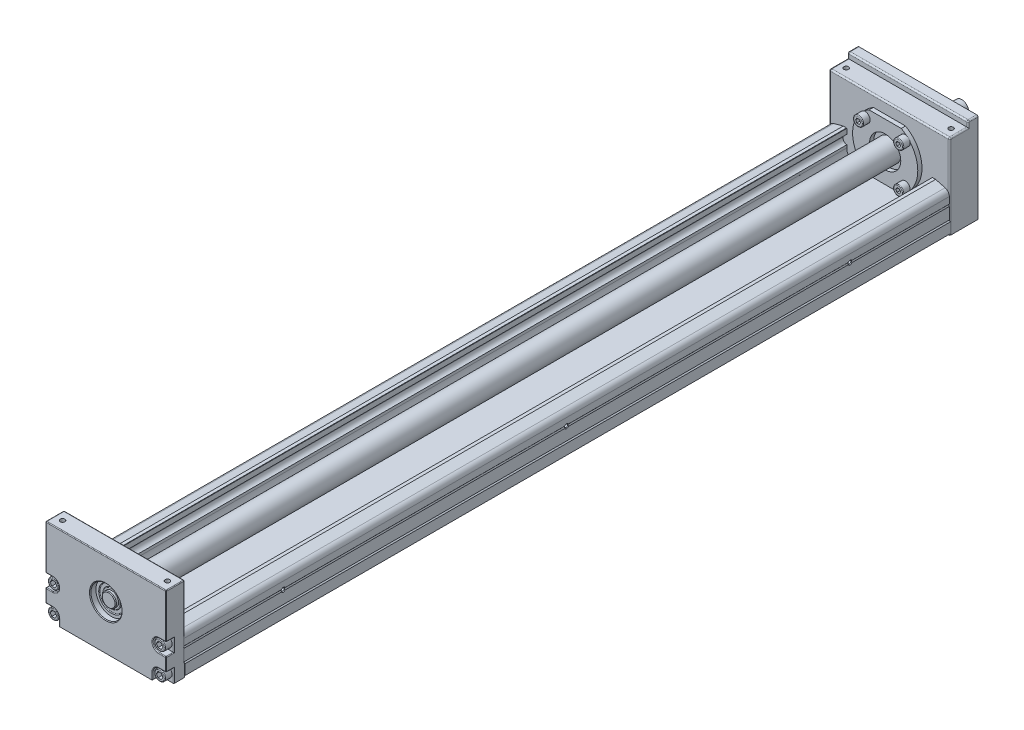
SolidWorks part; units mm, degrees
ref_plane "前视基准面" through (0, 0, 0) normal (0, 0, 1) x (1, 0, 0)
ref_plane "上视基准面" through (0, 0, 0) normal (0, 1, 0) x (1, 0, 0)
ref_plane "右视基准面" through (0, 0, 0) normal (1, 0, 0) x (0, 0, -1)
sketch "草图1" plane through (0, 0, 0) normal (0, 0, 1) x (1, 0, 0)
  line L0 (0, 0) -> (0, 14.97) construction
  line L1 (-11, 0.5) -> (11, 0.5)
  line L2 (11, 0.5) -> (11, 0)
  line L3 (11, 0) -> (33, 0) construction
  line L4 (33, 0) -> (33, 0.5)
  line L5 (33, 0.5) -> (41.5, 0.5)
  line L6 (43, 2) -> (43, 9.25) construction
  line L7 (43, 9.25) -> (42.25, 10)
  line L8 (42.25, 10) -> (42.25, 24.345)
  line L9 (39.2853, 28.2087) -> (32.6, 30)
  line L10 (32.6, 30) -> (30.1, 30) construction
  line L11 (30.1, 30) -> (30.1, 17.9)
  line L12 (30.1, 30) -> (30.1, 30.15)
  line L13 (13, 9.9) -> (-13, 9.9)
  line L14 (41.5, 0.5) -> (43, 2)
  line L15 (-41.5, 0.5) -> (-43, 2)
  line L16 (30.1, 30.15) -> (32.0402, 30.15)
  line L17 (-30.1, 30) -> (-30.1, 17.9)
  line L18 (-32.6, 30) -> (-30.1, 30) construction
  line L19 (-39.2853, 28.2087) -> (-32.6, 30)
  line L20 (-42.25, 10) -> (-42.25, 24.345)
  line L21 (-43, 9.25) -> (-42.25, 10)
  line L22 (-43, 2) -> (-43, 9.25) construction
  line L23 (-33, 0.5) -> (-41.5, 0.5)
  line L24 (-33, 0) -> (-33, 0.5)
  line L25 (-11, 0) -> (-33, 0) construction
  line L26 (-11, 0.5) -> (-11, 0)
  line L27 (13, 9.9) -> (22.1, 9.9)
  line L28 (32.0402, 30.15) -> (32.6, 30)
  line L29 (-13, 9.9) -> (-22.1, 9.9)
  line L30 (43, 9.25) -> (43.15, 9.1)
  line L31 (43.15, 9.1) -> (43.15, 2.15)
  line L32 (43.15, 2.15) -> (43, 2)
  line L33 (33, 0) -> (33, -0.5)
  line L34 (33, -0.5) -> (11, -0.5)
  line L35 (11, -0.5) -> (11, 0)
  line L36 (-11, -0.5) -> (-11, 0)
  line L37 (-33, -0.5) -> (-11, -0.5)
  line L38 (-33, 0) -> (-33, -0.5)
  line L39 (-43.15, 2.15) -> (-43, 2)
  line L40 (-43.15, 9.1) -> (-43.15, 2.15)
  line L41 (-43, 9.25) -> (-43.15, 9.1)
  line L42 (-30.1, 30) -> (-30.1, 30.15)
  line L43 (-30.1, 30.15) -> (-32.0402, 30.15)
  line L44 (-32.0402, 30.15) -> (-32.6, 30)
  arc A0 (42.25, 24.345) -> (39.2853, 28.2087) centre (38.25, 24.345) ccw
  arc A1 (-22.1, 9.9) -> (-30.1, 17.9) centre (-22.1, 17.9) cw
  arc A2 (22.1, 9.9) -> (30.1, 17.9) centre (22.1, 17.9) ccw
  arc A3 (-42.25, 24.345) -> (-39.2853, 28.2087) centre (-38.25, 24.345) cw
  point P9 (43, 0.5)
  point P24 (0, 0.5)
  point P25 (0, 9.9)
  point P40 (-43, 0.5)
  dimension "D16" = 4
  dimension "D17" = 13
  dimension "D15" = 8
  dimension "D1" = 0.5
  dimension "D2" = 0.5
  dimension "D3" = 43
  dimension "D4" = 42.25
  dimension "D5" = 2.5
  dimension "D6" = 30
  dimension "D7" = 15
  dimension "D8" = 9.4
  dimension "D9" = 22
  dimension "D10" = 11
  dimension "D11" = 10
  dimension "D12" = 45
  dimension "D13" = 30.1
  dimension "D14" = 13
  dimension "D19" = 22.1
  dimension "D20" = 22.1
  dimension "D21" = 0.5
  dimension "D22" = 0.15
  dimension "D23" = 0.15
extrude "总长" add sketch "草图1" along normal blind 540
sketch "草图2" plane through (0, 0, 0) normal (0, 0, -1) x (-1, 0, 0)
  line L0 (-33.1974, 23) -> (30.685, 23) construction
  line L1 (0, 0) -> (0, 24.2172) construction
  line L2 (-29.7, 23) -> (-31.9451, 25.2451) construction
  line L4 (-22.1, 9.9) -> (22.1, 9.9) construction
  line L5 (-30.1, 30.15) -> (-30.1, 17.9) construction
  line L6 (-32.8, 22.7) -> (-32.8, 23.3)
  line L7 (-32.6, 23.5) -> (-32.3495, 23.5)
  line L8 (-29.6116, 22.9116) -> (-32.6, 23.3) construction
  line L9 (-32.6, 23.3) -> (-32.8841, 23.3369) construction
  line L10 (-32.6, 22.5) -> (-32.3495, 22.5)
  line L11 (32.6, 22.5) -> (32.3495, 22.5)
  line L12 (32.8, 22.7) -> (32.8, 23.3)
  line L13 (32.6, 23.5) -> (32.3495, 23.5)
  circle A0 centre (-29.7, 23) radius 3.175 construction
  arc A1 (-26.3128, 23) -> (-32.9104, 23) centre (-29.6116, 22.9116) ccw construction
  arc A2 (-26.3128, 23) -> (-32.9104, 23) centre (-29.6116, 23.0884) cw construction
  arc A3 (26.3128, 23) -> (32.9104, 23) centre (29.6116, 23.0884) ccw construction
  arc A4 (26.3128, 23) -> (32.9104, 23) centre (29.6116, 22.9116) cw construction
  arc A5 (-32.3495, 22.5) -> (-32.3495, 23.5) centre (-29.9, 23) ccw
  arc A6 (-32.8, 23.3) -> (-32.6, 23.5) centre (-32.6, 23.3) cw
  arc A7 (-32.8, 22.7) -> (-32.6, 22.5) centre (-32.6, 22.7) ccw
  arc A8 (32.8, 22.7) -> (32.6, 22.5) centre (32.6, 22.7) cw
  arc A9 (32.8, 23.3) -> (32.6, 23.5) centre (32.6, 23.3) ccw
  arc A10 (32.3495, 22.5) -> (32.3495, 23.5) centre (29.9, 23) cw
  point P20 (-31.5649, 24.8649)
  point P21 (-30.1, 26.1753)
  point P22 (-30.1, 25.492)
  point P31 (-32.7983, 23.3258)
  point P33 (-32.8, 23)
  dimension "D2" = 6.35
  dimension "D5" = 6.6
  dimension "D6" = 5
  dimension "D10" = 0.2
  dimension "D1" = 13.1
  dimension "D3" = 59.4
  dimension "D4" = 45
  dimension "D7" = 59.8
  dimension "D8" = 0.5376
  dimension "D9" = 0.6833
  dimension "D11" = 1
  dimension "D12" = 65.6
  dimension "D13" = 0.0865
extrude "预拉滚道" cut sketch "草图2" against normal through all
hole_wizard "cekong" positions "草图4" profile "草图3" tap size "M2.5" standard "GB"
sketch "草图4" plane through (-42.25, 0, 0) normal (-1, 0, 0) x (0, 0, 1)
  line L2 (0, 24.345) -> (0, 10) construction
  point P0 (70, 19)
  dimension "D3" = 19
  dimension "ckdj" = 70
sketch "草图3" plane through (-42.25, 19, 70) normal (0, 1, 0) x (0, 0, 1)
  line L0 (0, 0) -> (0, 6.1159)
  line L1 (0, 6.1159) -> (1.025, 5.5)
  line L2 (1.025, 5.5) -> (1.025, 0.475)
  line L3 (1.025, 0.475) -> (1.5, 0)
  line L5 (1.5, 0) -> (0, 0)
  line L6 (-1.025, 0.475) -> (-1.5, 0) construction
  line L10 (0, 6.1159) -> (-1.025, 5.5) construction
  line L11 (0, -6.35) -> (0, 107.95) construction
  dimension "螺纹孔钻头直径" = 2.05
  dimension "螺纹孔钻头深度" = 5.5
  dimension "近端锥形沉头孔直径" = 3
  dimension "近端锥形沉头孔角度" = 90
  dimension "导头角度" = 118
pattern_linear "ckzl" count 3 spacing 200 along (0, 0, 1) of "cekong"
mirror "镜向3" about plane through (0, 0, 0) normal (1, 0, 0) of "ckzl", "cekong"
hole_wizard "dikong" positions "草图6" profile "草图5" counterbore size "M6" standard "GB"
sketch "草图6" plane through (6.505, 30.15, 0) normal (0, 1, 0) x (1, 0, 0)
  line L1 (15.595, 0) -> (-28.605, 0) construction
  point P0 (-29.505, -70)
  dimension "D2" = 23
  dimension "dkdj" = 70
sketch "草图5" plane through (-23, 30.15, 70) normal (1, 0, 0) x (0, 0, 1)
  line L0 (0, 0) -> (0, 30.65)
  line L1 (3.3, 29.95) -> (4, 30.65)
  line L2 (3.3, 29.95) -> (3.3, 25.65)
  line L3 (3.3, 25.65) -> (5.5, 25.65)
  line L4 (5.5, 25.65) -> (5.5, 0)
  line L5 (5.5, 0) -> (0, 0)
  line L11 (0, -6.35) -> (0, 107.95) construction
  line L12 (4, 30.65) -> (0, 30.65)
  line L13 (-3.3, 29.95) -> (-4, 30.65) construction
  dimension "通孔孔直径" = 6.6
  dimension "通孔孔深度" = 30.65
  dimension "柱形沉头孔直径" = 11
  dimension "柱形沉头孔深度" = 25.65
  dimension "远端锥形沉头孔直径" = 8
  dimension "远端锥形沉头孔角度" = 90
pattern_linear "dkzl" count 5 spacing 100 along (0, 0, 1) count 2 spacing 46 along (1, 0, 0) of "dikong"
ref_plane "基准面1" through (0, 0, 270) normal (0, 0, 1) x (1, 0, 0)
sketch "草图9" plane through (0, 0, 0) normal (0, 0, -1) x (-1, 0, 0)
  line L0 (42.25, 24.345) -> (42.25, 10) construction
  line L2 (0, 0) -> (0, 25.541) construction
  line L3 (36.1341, 19) -> (47.0239, 19) construction
  line L5 (40.5408, 6) -> (48.9402, 6) construction
  line L8 (42.7, 5.25) -> (51.3153, 5.25)
  line L9 (42.5, 5.45) -> (42.5, 6.55)
  line L10 (42.7, 6.75) -> (51.3153, 6.75)
  line L11 (51.3153, 5.25) -> (51.3153, 6.75)
  line L12 (42.5, 5.25) -> (51.3153, 6.75) construction
  line L13 (42.5, 6.75) -> (51.3153, 5.25) construction
  circle A0 centre (43.6, 6) radius 1 construction
  circle A1 centre (42.95, 19) radius 1
  circle A2 centre (-42.95, 19) radius 1
  arc A3 (42.7, 5.25) -> (42.5, 5.45) centre (42.7, 5.45) cw
  arc A4 (42.5, 6.55) -> (42.7, 6.75) centre (42.7, 6.55) cw
  point P20 (46.9077, 6)
  dimension "D1" = 2
  dimension "D4" = 2
  dimension "D8" = 0.2
  dimension "D2" = 87.2
  dimension "D3" = 13
  dimension "D5" = 0.7
  dimension "D6" = 1.5
  dimension "D7" = 85
extrude "标识槽" cut sketch "草图9" against normal through all
chamfer "倒角1" distance 0.35 angle 45 2 edges at (-30.1, 30.15, 270) (30.1, 30.15, 270)
chamfer "倒角2" distance 1 angle 45 4 edges at (-11, -0.5, 270) (-33, -0.5, 270) (11, -0.5, 270) (33, -0.5, 270)
sketch "草图11" plane through (0, 0, 0) normal (0, 0, -1) x (-1, 0, 0)
  line L0 (-32.0402, 30.15) -> (-30.45, 30.15) construction
  line L1 (-43, 30) -> (43, 30)
  line L2 (-43, 30) -> (-43, 0)
  line L3 (-43, 0) -> (43, 0)
  line L4 (43, 30) -> (43, 0)
  line L5 (-43.15, 2.15) -> (-43.15, 9.1) construction
  line L6 (43.15, 5.25) -> (43.15, 2.15) construction
  line L7 (32, -0.5) -> (12, -0.5) construction
  dimension "D1" = 0.15
  dimension "D2" = 0.15
  dimension "D3" = 0.15
  dimension "D4" = 0.5
extrude "切除-拉伸3" cut sketch "草图11" against normal through all flip side to cut
sketch "草图12" plane through (0, 0, 0) normal (0, 0, -1) x (-1, 0, 0)
  line L0 (0, 0) -> (0, 23) construction
  line L1 (0, 23) -> (-51.3359, 23) construction
  line L2 (-32.5, 0) -> (-11.5, 0) construction
  line L3 (-29.7, 23) -> (-31.9451, 25.2451)
  circle A0 centre (-29.7, 23) radius 3.175 construction
  arc A1 (-26.2025, 23) -> (-32.9281, 23) centre (-29.5653, 22.8653) ccw
  arc A2 (-26.2025, 23) -> (-32.9281, 23) centre (-29.5653, 23.1347) cw
  arc A3 (26.2025, 23) -> (32.9281, 23) centre (29.5653, 22.8653) cw
  arc A4 (26.2025, 23) -> (32.9281, 23) centre (29.5653, 23.1347) ccw
extrude "切除-拉伸4" cut sketch "草图12" against normal through all
sketch "草图13" plane through (0, 0, 0) normal (0, 0, -1) x (-1, 0, 0)
  line L0 (0, 0) -> (0, 45.4622) construction
  line L1 (-42.5, 64) -> (42.5, 64)
  line L2 (-42.5, 64) -> (-42.5, 0.5)
  line L3 (-42.5, 0.5) -> (42.5, 0.5)
  line L4 (42.5, 64) -> (42.5, 0.5)
  line L5 (11, 0.5) -> (-11, 0.5) construction
  dimension "D1" = 85
  dimension "D2" = 63.5
extrude "凸台-拉伸1" add sketch "草图13" along normal blind 87 separate body
sketch "草图15" plane through (42.5, 0, 0) normal (1, 0, 0) x (0, 0, -1)
  line L1 (15, 0.5) -> (73, 0.5)
  line L2 (23, 30.5) -> (23, 49.5)
  line L3 (23, 49.5) -> (73, 49.5)
  line L4 (73, 0.5) -> (73, 49.5)
  line L5 (0, 64) -> (0, 0.5) construction
  line L6 (15, 0.5) -> (15, 30.5)
  line L7 (15, 30.5) -> (23, 30.5)
  line L8 (87, 0.5) -> (0, 0.5) construction
  line L9 (23, 0.5) -> (23, 49.5) construction
  line L10 (15, 30.5) -> (73, 30.5) construction
  line L11 (15, 0.5) -> (15, 49.5) construction
  dimension "D1" = 23
  dimension "D2" = 50
  dimension "D3" = 49
  dimension "D4" = 8
  dimension "D5" = 30
extrude "切除-拉伸5" cut sketch "草图15" against normal blind 17.5
sketch "草图16" plane through (-42.5, 0, 0) normal (-1, 0, 0) x (0, 0, 1)
  line L6 (-73, 49.5) -> (-73, 0.5)
  line L7 (-23, 49.5) -> (-73, 49.5)
  line L8 (-23, 30.5) -> (-23, 49.5)
  line L9 (-15, 30.5) -> (-23, 30.5)
  line L10 (-15, 0.5) -> (-15, 30.5)
  line L11 (-73, 0.5) -> (-15, 0.5)
  line L12 (-73, 49.5) -> (-73, 0.5)
  line L13 (-23, 49.5) -> (-73, 49.5)
  line L14 (-23, 30.5) -> (-23, 49.5)
  line L15 (-15, 30.5) -> (-23, 30.5)
  line L16 (-15, 0.5) -> (-15, 30.5)
  line L17 (-73, 0.5) -> (-15, 0.5)
  dimension "D1" = 0
extrude "切除-拉伸6" cut sketch "草图16" against normal blind 17.5
sketch "草图18" plane through (0, 0, -87) normal (0, 0, -1) x (-1, 0, 0)
  line L0 (0, 0) -> (0, 32) construction
  circle A0 centre (0, 32) radius 23
  dimension "D1" = 46
  dimension "D2" = 32
extrude "切除-拉伸7" cut sketch "草图18" against normal blind 64
sketch "草图19" plane through (0, 0, -87) normal (0, 0, -1) x (-1, 0, 0)
  circle A0 centre (0, 32) radius 25
  dimension "D1" = 50
extrude "切除-拉伸8" cut sketch "草图19" against normal blind 3.5
sketch "草图20" plane through (0, 64, 0) normal (0, 1, 0) x (1, 0, 0)
  line L0 (0, 87) -> (0, -17.8608) construction
  line L1 (-42.5, 87) -> (42.5, 87) construction
  line L2 (-25, 73) -> (-42.5, 73) construction
  line L3 (-30, 73) -> (30, 73)
  line L4 (-30, 73) -> (-30, 23)
  line L5 (-30, 23) -> (30, 23)
  line L6 (30, 73) -> (30, 23)
  line L7 (23, 23) -> (-23, 23) construction
  dimension "D1" = 60
extrude "切除-拉伸9" cut sketch "草图20" against normal blind 43
fillet "圆角1" radius 3 6 edges at (-30, 56.75, -23) (-30, 56.75, -73) (30, 56.75, -73) (30, 56.75, -23) (-33.75, 30.5, -23) (33.75, 30.5, -23)
fillet "圆角2" radius 5 6 edges at (33.75, 30.5, -15) (34.75, 49.5, -73) (-34.75, 49.5, -73) (-33.75, 30.5, -15) (-34.75, 49.5, -23) (34.75, 49.5, -23)
sketch "草图22" plane through (42.5, 0, 0) normal (1, 0, 0) x (0, 0, -1)
  line L1 (0, 64) -> (13, 64)
  line L2 (0, 64) -> (0, 60)
  line L3 (0, 60) -> (13, 60)
  line L4 (13, 64) -> (13, 60)
  dimension "D1" = 13
  dimension "D2" = 4
extrude "切除-拉伸10" cut sketch "草图22" against normal through all
sketch "草图23" plane through (0, 0, -23) normal (0, 0, -1) x (-1, 0, 0)
  circle A0 centre (0, 32) radius 11
  dimension "D1" = 22
extrude "切除-拉伸11" cut sketch "草图23" against normal blind 5.5
sketch "草图24" plane through (0, 0, -17.5) normal (0, 0, -1) x (-1, 0, 0)
  circle A0 centre (0, 32) radius 8.5
  dimension "D1" = 17
extrude "凸台-拉伸3" add sketch "草图24" along normal blind 6
sketch "草图25" plane through (0, 0, -23.5) normal (0, 0, -1) x (-1, 0, 0)
  circle A0 centre (0, 32) radius 6
  dimension "D1" = 12
extrude "凸台-拉伸4" add sketch "草图25" along normal blind 7.5
sketch "草图26" plane through (0, 0, -23.5) normal (0, 0, -1) x (-1, 0, 0)
  line L0 (0, 45.435) -> (0, 32) construction
  line L1 (-2.7964, 42.6386) -> (-10.6386, 34.7964)
  line L2 (-10.6386, 29.2036) -> (-2.7964, 21.3614)
  line L3 (2.7964, 21.3614) -> (10.6386, 29.2036)
  line L4 (10.6386, 34.7964) -> (2.7964, 42.6386)
  circle A0 centre (0, 32) radius 9.5 construction
  arc A1 (-10.6386, 34.7964) -> (-10.6386, 29.2036) centre (0, 32) ccw
  arc A4 (-2.7964, 21.3614) -> (2.7964, 21.3614) centre (0, 32) ccw
  arc A5 (10.6386, 29.2036) -> (10.6386, 34.7964) centre (0, 32) ccw
  arc A6 (2.7964, 42.6386) -> (-2.7964, 42.6386) centre (0, 32) ccw
  point P14 (-1.5, 41)
  point P15 (-1.5, 21)
  point P18 (1.5, 41)
  point P19 (1.5, 21)
  dimension "D1" = 19
  dimension "D2" = 22
extrude "凸台-拉伸5" add sketch "草图26" along normal blind 6.5 separate body
sketch "草图27" plane through (0, 0, -31) normal (0, 0, -1) x (-1, 0, 0)
  circle A0 centre (0, 32) radius 5
  dimension "D1" = 10
extrude "凸台-拉伸6" add sketch "草图27" along normal blind 20
fillet "圆角3" radius 1 38 edges at (42.5, 13, -15) (42.5, 29.0355, -16.4645) (42.5, 31.3787, -22.1213) (42.5, 39, -23) (42.5, 48.0355, -24.4645) (42.5, 49.5, -48) (42.5, 48.0355, -71.5355) (-42.5, 13, -15) (-42.5, 29.0355, -16.4645) (-42.5, 31.3787, -22.1213) (-42.5, 39, -23) (-42.5, 48.0355, -24.4645) (-42.5, 49.5, -48) (-42.5, 48.0355, -71.5355) (-42.5, 30.25, 0) (42.5, 30.25, 0) (-42.5, 0.5, -80) (42.5, 0.5, -80) (0, 0.5, -87) (42.5, 22.5, -73) (42.5, 32.25, -87) (-42.5, 22.5, -73) (-42.5, 32.25, -87) (42.5, 60, -6.5) (42.5, 62, -13) (0, 60, 0) (0, 64, -13) (-42.5, 62, -13) (-42.5, 60, -6.5) (-42.5, 64, -50) (0, 64, -87) (42.5, 64, -50) (-33.75, 0.5, -15) (-25, 0.5, -44) (-33.75, 0.5, -73) (33.75, 0.5, -73) (25, 0.5, -44) (33.75, 0.5, -15)
sketch "草图28" plane through (0, 0, 540) normal (0, 0, 1) x (1, 0, 0)
  line L0 (-41.5, 0.5) -> (-33, 0.5) construction
  line L1 (-42.5, 0.5) -> (42.5, 0.5)
  line L2 (-42.5, 0.5) -> (-42.5, 60)
  line L3 (-42.5, 60) -> (42.5, 60)
  line L4 (42.5, 0.5) -> (42.5, 60)
  line L5 (-42.5, 0.5) -> (-42.5, 59) construction
  line L6 (-41.5, 60) -> (41.5, 60) construction
  line L7 (42.5, 59) -> (42.5, 0.5) construction
extrude "凸台-拉伸7" add sketch "草图28" along normal blind 13
hole_wizard "M4 螺纹孔1" positions "草图30" profile "草图29" tap size "M4" standard "GB"
sketch "草图30" plane through (0, 60, 0) normal (0, 1, 0) x (1, 0, 0)
  line L0 (0, 86) -> (0, -553) construction
  line L1 (41.5, 86) -> (-41.5, 86) construction
  line L2 (42.5, -553) -> (-42.5, -553) construction
  line L4 (-41.5, 13) -> (41.5, 13) construction
  point P0 (-37, -546.5)
  point P2 (37, -546.5)
  point P4 (-37, 6.5)
  point P6 (37, 6.5)
  dimension "D1" = 74
  dimension "D2" = 6.5
  dimension "D3" = 6.5
sketch "草图29" plane through (-37, 60, 546.5) normal (1, 0, 0) x (0, 0, 1)
  line L0 (0, 0) -> (0, 11.0914)
  line L1 (0, 11.0914) -> (1.65, 10.1)
  line L2 (1.65, 10.1) -> (1.65, 0)
  line L5 (1.65, 0) -> (0, 0)
  line L10 (0, 11.0914) -> (-1.65, 10.1) construction
  line L11 (0, -6.35) -> (0, 107.95) construction
  dimension "螺纹孔钻头直径" = 3.3
  dimension "螺纹孔钻头深度" = 10.1
  dimension "导头角度" = 118
sketch "草图32" plane through (0, 0, 0) normal (0, 0, 1) x (1, 0, 0)
  circle A0 centre (0, 32) radius 8
  dimension "D1" = 16
extrude "凸台-拉伸8" add sketch "草图32" along normal up to surface (540 mm away)
sketch "草图33" plane through (0, 0, 553) normal (0, 0, 1) x (1, 0, 0)
  circle A0 centre (0, 32) radius 11
extrude "切除-拉伸12" cut sketch "草图33" against normal blind 4
sketch "草图34" plane through (0, 0, 549) normal (0, 0, 1) x (1, 0, 0)
  circle A0 centre (0, 32) radius 5
  dimension "D1" = 10
extrude "凸台-拉伸9" add sketch "草图34" along normal blind 2
sketch "草图35" plane through (0, 0, 553) normal (0, 0, 1) x (1, 0, 0)
  line L0 (0, 32) -> (0, 0) construction
  line L1 (-11.5, 0) -> (-32.5, 0) construction
  line L2 (-42.5, 60) -> (-42.5, 0.5) construction
  line L3 (42.5, 0.5) -> (42.5, 60) construction
  line L4 (-42.5, 28.5) -> (-42.5, 19.5)
  line L5 (42.5, 0.5) -> (42.5, 10)
  line L6 (-37.5, 28.5) -> (-42.5, 28.5)
  line L7 (-37.5, 19.5) -> (-42.5, 19.5)
  line L8 (-37.5, 10) -> (-42.5, 10)
  line L9 (-33, 5.5) -> (-33, 0.5)
  line L10 (-42.5, 0.5) -> (-33, 0.5)
  line L11 (-42.5, 10) -> (-42.5, 0.5)
  line L12 (37.5, 28.5) -> (42.5, 28.5)
  line L13 (37.5, 19.5) -> (42.5, 19.5)
  line L14 (37.5, 10) -> (42.5, 10)
  line L15 (33, 5.5) -> (33, 0.5)
  line L16 (33, 0.5) -> (42.5, 0.5)
  line L17 (-42.5, 0.5) -> (42.5, 0.5) construction
  line L18 (42.5, 19.5) -> (42.5, 28.5)
  arc A0 (-37.5, 19.5) -> (-37.5, 28.5) centre (-37.5, 24) ccw
  arc A1 (-33, 5.5) -> (-37.5, 10) centre (-37.5, 5.5) ccw
  arc A2 (37.5, 28.5) -> (37.5, 19.5) centre (37.5, 24) ccw
  arc A3 (37.5, 10) -> (33, 5.5) centre (37.5, 5.5) ccw
  dimension "D1" = 75
  dimension "D2" = 5.5
  dimension "D3" = 18.5
  dimension "D4" = 9
extrude "切除-拉伸13" cut sketch "草图35" against normal blind 5.5
sketch "草图36" plane through (0, 0, 547.5) normal (0, 0, 1) x (1, 0, 0)
  circle A0 centre (-37.5, 24) radius 3.75
  circle A1 centre (-37.5, 5.5) radius 3.75
  circle A2 centre (37.5, 5.5) radius 3.75
  circle A3 centre (37.5, 24) radius 3.75
  dimension "D1" = 7.5
extrude "凸台-拉伸10" add sketch "草图36" along normal blind 5
sketch "草图37" plane through (0, 0, 552.5) normal (0, 0, 1) x (1, 0, 0)
  line L1 (-36.3453, 26) -> (-38.6547, 26)
  line L2 (-38.6547, 26) -> (-39.8094, 24)
  line L3 (-39.8094, 24) -> (-38.6547, 22)
  line L4 (-38.6547, 22) -> (-36.3453, 22)
  line L5 (-36.3453, 22) -> (-35.1906, 24)
  line L6 (-35.1906, 24) -> (-36.3453, 26)
  line L7 (-36.3453, 7.5) -> (-38.6547, 7.5)
  line L8 (-38.6547, 7.5) -> (-39.8094, 5.5)
  line L9 (-39.8094, 5.5) -> (-38.6547, 3.5)
  line L10 (-38.6547, 3.5) -> (-36.3453, 3.5)
  line L11 (-36.3453, 3.5) -> (-35.1906, 5.5)
  line L12 (-35.1906, 5.5) -> (-36.3453, 7.5)
  line L13 (36.3453, 7.5) -> (35.1906, 5.5)
  line L14 (35.1906, 5.5) -> (36.3453, 3.5)
  line L15 (36.3453, 3.5) -> (38.6547, 3.5)
  line L16 (38.6547, 3.5) -> (39.8094, 5.5)
  line L17 (39.8094, 5.5) -> (38.6547, 7.5)
  line L18 (38.6547, 7.5) -> (36.3453, 7.5)
  line L19 (36.3453, 26) -> (35.1906, 24)
  line L20 (35.1906, 24) -> (36.3453, 22)
  line L21 (36.3453, 22) -> (38.6547, 22)
  line L22 (38.6547, 22) -> (39.8094, 24)
  line L23 (39.8094, 24) -> (38.6547, 26)
  line L24 (38.6547, 26) -> (36.3453, 26)
  circle A0 centre (-37.5, 24) radius 2 construction
  circle A1 centre (-37.5, 5.5) radius 2 construction
  circle A2 centre (37.5, 5.5) radius 2 construction
  circle A3 centre (37.5, 24) radius 2 construction
  dimension "D1" = 4
extrude "切除-拉伸14" cut sketch "草图37" against normal blind 3.5
fillet "圆角4" radius 0.5 39 edges at (40, 28.5, 553) (33, 24, 553) (33, 3, 553) (34.318, 8.682, 553) (-33, 3, 553) (-40, 10, 553) (-40, 28.5, 553) (-33, 24, 553) (-42.5, 34.875, 540) (42.5, 34.875, 540) (42.5, 14.75, 553) (42.5, 44.25, 553) (42.5, 60, 546.5) (0, 60, 540) (-42.5, 60, 546.5) (0, 60, 553) (-42.5, 19.5, 550.25) (-42.5, 24, 547.5) (-42.5, 28.5, 550.25) (33, 0.5, 550.25) (42.5, 10, 550.25) (42.5, 5.25, 547.5) (42.5, 19.5, 550.25) (42.5, 24, 547.5) (42.5, 28.5, 550.25) (-33, 0.5, 550.25) (-37.75, 0.5, 547.5) (-42.5, 5.25, 547.5) (-42.5, 10, 550.25) (-42.5, 14.75, 553) (-42.5, 44.25, 553) (41.25, 24, 552.5) (40, 19.5, 553) (40, 10, 553) (41.25, 5.5, 552.5) (-34.318, 8.682, 553) (-40, 19.5, 553) (-33.75, 24, 552.5) (-33.75, 5.5, 552.5)
sketch "草图38" plane through (0, 0, -87) normal (0, 0, -1) x (-1, 0, 0)
  circle A0 centre (-37.5, 24) radius 2.25
  circle A1 centre (-37.5, 5.5) radius 2.25
  circle A2 centre (37.5, 5.5) radius 2.25
  circle A3 centre (37.5, 24) radius 2.25
  dimension "D1" = 4.5
extrude "切除-拉伸15" cut sketch "草图38" against normal blind 23.5
sketch "草图39" plane through (0, 0, -15) normal (0, 0, -1) x (-1, 0, 0)
  circle A0 centre (37.5, 24) radius 3.75 construction
  circle A1 centre (37.5, 5.5) radius 3.75 construction
  circle A2 centre (-37.5, 24) radius 3.75 construction
  circle A3 centre (-37.5, 5.5) radius 3.75 construction
  circle A4 centre (37.5, 24) radius 3.75
  circle A5 centre (37.5, 5.5) radius 3.75
  circle A6 centre (-37.5, 24) radius 3.75
  circle A7 centre (-37.5, 5.5) radius 3.75
extrude "凸台-拉伸11" add sketch "草图39" along normal blind 5
sketch "草图40" plane through (0, 0, -20) normal (0, 0, -1) x (-1, 0, 0)
  line L0 (35.1906, 24) -> (36.3453, 26) construction
  line L1 (36.3453, 26) -> (38.6547, 26) construction
  line L2 (38.6547, 26) -> (39.8094, 24) construction
  line L3 (39.8094, 24) -> (38.6547, 22) construction
  line L4 (38.6547, 22) -> (36.3453, 22) construction
  line L5 (36.3453, 22) -> (35.1906, 24) construction
  line L6 (35.1906, 5.5) -> (36.3453, 7.5) construction
  line L7 (36.3453, 7.5) -> (38.6547, 7.5) construction
  line L8 (38.6547, 7.5) -> (39.8094, 5.5) construction
  line L9 (39.8094, 5.5) -> (38.6547, 3.5) construction
  line L10 (38.6547, 3.5) -> (36.3453, 3.5) construction
  line L11 (36.3453, 3.5) -> (35.1906, 5.5) construction
  line L12 (-38.6547, 26) -> (-36.3453, 26) construction
  line L13 (-36.3453, 26) -> (-35.1906, 24) construction
  line L14 (-35.1906, 24) -> (-36.3453, 22) construction
  line L15 (-36.3453, 22) -> (-38.6547, 22) construction
  line L16 (-38.6547, 22) -> (-39.8094, 24) construction
  line L17 (-39.8094, 24) -> (-38.6547, 26) construction
  line L18 (-38.6547, 7.5) -> (-36.3453, 7.5) construction
  line L19 (-36.3453, 7.5) -> (-35.1906, 5.5) construction
  line L20 (-35.1906, 5.5) -> (-36.3453, 3.5) construction
  line L21 (-36.3453, 3.5) -> (-38.6547, 3.5) construction
  line L22 (-38.6547, 3.5) -> (-39.8094, 5.5) construction
  line L23 (-39.8094, 5.5) -> (-38.6547, 7.5) construction
  line L24 (35.1906, 24) -> (36.3453, 26)
  line L25 (36.3453, 26) -> (38.6547, 26)
  line L26 (38.6547, 26) -> (39.8094, 24)
  line L27 (39.8094, 24) -> (38.6547, 22)
  line L28 (38.6547, 22) -> (36.3453, 22)
  line L29 (36.3453, 22) -> (35.1906, 24)
  line L30 (35.1906, 5.5) -> (36.3453, 7.5)
  line L31 (36.3453, 7.5) -> (38.6547, 7.5)
  line L32 (38.6547, 7.5) -> (39.8094, 5.5)
  line L33 (39.8094, 5.5) -> (38.6547, 3.5)
  line L34 (38.6547, 3.5) -> (36.3453, 3.5)
  line L35 (36.3453, 3.5) -> (35.1906, 5.5)
  line L36 (-38.6547, 26) -> (-36.3453, 26)
  line L37 (-36.3453, 26) -> (-35.1906, 24)
  line L38 (-35.1906, 24) -> (-36.3453, 22)
  line L39 (-36.3453, 22) -> (-38.6547, 22)
  line L40 (-38.6547, 22) -> (-39.8094, 24)
  line L41 (-39.8094, 24) -> (-38.6547, 26)
  line L42 (-38.6547, 7.5) -> (-36.3453, 7.5)
  line L43 (-36.3453, 7.5) -> (-35.1906, 5.5)
  line L44 (-35.1906, 5.5) -> (-36.3453, 3.5)
  line L45 (-36.3453, 3.5) -> (-38.6547, 3.5)
  line L46 (-38.6547, 3.5) -> (-39.8094, 5.5)
  line L47 (-39.8094, 5.5) -> (-38.6547, 7.5)
extrude "切除-拉伸16" cut sketch "草图40" against normal blind 3
fillet "圆角5" radius 0.5 4 edges at (-37.5, 27.75, -20) (-37.5, 9.25, -20) (37.5, 9.25, -20) (37.5, 27.75, -20)
hole_wizard "M4 螺纹孔2" positions "草图42" profile "草图41" tap size "M4" standard "GB"
sketch "草图42" plane through (0, 0, -87) normal (0, 0, -1) x (-1, 0, 0)
  line L0 (-25, 32) -> (0, 32) construction
  line L1 (0, 32) -> (0, 57) construction
  line L3 (-25.9808, 47) -> (25.9808, 17) construction
  line L5 (25.9808, 47) -> (-25.9808, 17) construction
  circle A0 centre (0, 32) radius 25 construction
  circle A1 centre (0, 32) radius 25 construction
  circle A2 centre (0, 32) radius 30
  point P0 (-25.9808, 47)
  point P2 (-25.9808, 17)
  point P4 (25.9808, 17)
  point P6 (25.9808, 47)
  dimension "D1" = 30
  dimension "D3" = 60
  dimension "D2" = 30
sketch "草图41" plane through (25.9808, 47, -87) normal (1, 0, 0) x (0, 1, 0)
  line L0 (0, 0) -> (0, 11.0914)
  line L1 (0, 11.0914) -> (1.65, 10.1)
  line L2 (1.65, 10.1) -> (1.65, 0)
  line L5 (1.65, 0) -> (0, 0)
  line L10 (0, 11.0914) -> (-1.65, 10.1) construction
  line L11 (0, -6.35) -> (0, 107.95) construction
  dimension "螺纹孔钻头直径" = 3.3
  dimension "螺纹孔钻头深度" = 10.1
  dimension "导头角度" = 118
hole_wizard "M5 螺纹孔1" positions "草图44" profile "草图43" tap size "M5" standard "GB"
sketch "草图44" plane through (0, 0, -87) normal (0, 0, -1) x (-1, 0, 0)
  line L0 (0, 67) -> (0, 32) construction
  line L1 (0, 32) -> (-35, 32) construction
  line L3 (-24.7487, 56.7487) -> (24.7487, 7.2513) construction
  line L5 (24.7487, 56.7487) -> (-24.7487, 7.2513) construction
  circle A0 centre (0, 32) radius 35 construction
  point P0 (-24.7487, 56.7487)
  point P14 (24.7487, 7.2513)
  point P17 (24.7487, 56.7487)
  point P18 (-24.7487, 7.2513)
  dimension "D1" = 45
  dimension "D3" = 70
  dimension "D2" = 45
sketch "草图43" plane through (24.7487, 56.7487, -87) normal (1, 0, 0) x (0, 1, 0)
  line L0 (0, 0) -> (0, 13.6618)
  line L1 (0, 13.6618) -> (2.1, 12.4)
  line L2 (2.1, 12.4) -> (2.1, 0)
  line L5 (2.1, 0) -> (0, 0)
  line L10 (0, 13.6618) -> (-2.1, 12.4) construction
  line L11 (0, -6.35) -> (0, 107.95) construction
  dimension "螺纹孔钻头直径" = 4.2
  dimension "螺纹孔钻头深度" = 12.4
  dimension "导头角度" = 118
sketch "草图45" plane through (0, 0.5, 0) normal (0, -1, 0) x (1, 0, 0)
  line L0 (0, -87) -> (0, 0) construction
  line L1 (41.5, -87) -> (-41.5, -87) construction
  line L2 (-25, -44) -> (25, -44) construction
  line L3 (-25, -73) -> (-25, -15) construction
  line L4 (25, -15) -> (25, -73) construction
  line L6 (-18, -28) -> (18, -28)
  line L7 (-21, -31) -> (-21, -57)
  line L8 (-18, -60) -> (18, -60)
  line L9 (21, -31) -> (21, -57)
  arc A0 (21, -31) -> (18, -28) centre (18, -31) ccw
  arc A1 (18, -60) -> (21, -57) centre (18, -57) ccw
  arc A2 (-18, -60) -> (-21, -57) centre (-18, -57) cw
  arc A3 (-21, -31) -> (-18, -28) centre (-18, -31) cw
  dimension "D1" = 3
  dimension "D2" = 32
  dimension "D3" = 42
extrude "切除-拉伸17" cut sketch "草图45" against normal blind 0.5
sketch "草图46" plane through (0, 1, 0) normal (0, -1, 0) x (1, 0, 0)
  line L0 (-21, -31) -> (-21, -57) construction
  line L1 (-18, -60) -> (18, -60) construction
  text T0 "KKR86" font "汉仪长仿宋体" height in points 42
  dimension "D1" = 6
  dimension "D2" = 10
extrude "凸台-拉伸12" add sketch "草图46" along normal blind 0.5
sketch "草图47" plane through (0, 0, 0) normal (0, 0, 1) x (1, 0, 0)
  line L0 (-23, 32) -> (23, 32) construction
  line L1 (-11.3578, 12) -> (11.3578, 12)
  line L2 (-11.3578, 52) -> (11.3578, 52)
  line L4 (-23, 52) -> (23, 52) construction
  line L5 (-23, 12) -> (23, 12) construction
  arc A0 (-11.3578, 52) -> (-11.3578, 12) centre (0, 32) ccw
  arc A1 (11.3578, 12) -> (11.3578, 52) centre (0, 32) ccw
  circle A2 centre (0, 32) radius 11
  dimension "D1" = 20
  dimension "D3" = 23
  dimension "D4" = 22
  dimension "D2" = 20
extrude "凸台-拉伸13" add sketch "草图47" along normal blind 3
sketch "草图48" plane through (0, 0, 3) normal (0, 0, 1) x (1, 0, 0)
  line L0 (0, 52) -> (0, 32) construction
  line L1 (0, 32) -> (-20, 32) construction
  line L2 (-14.1421, 46.1421) -> (14.1421, 17.8579) construction
  line L3 (14.1421, 46.1421) -> (-14.1421, 17.8579) construction
  circle A0 centre (0, 32) radius 20 construction
  circle A1 centre (-14.1421, 46.1421) radius 3.5
  circle A2 centre (14.1421, 46.1421) radius 3.5
  circle A3 centre (14.1421, 17.8579) radius 3.5
  circle A4 centre (-14.1421, 17.8579) radius 3.5
  dimension "D1" = 40
  dimension "D4" = 7
  dimension "D2" = 45
  dimension "D3" = 45
extrude "凸台-拉伸14" add sketch "草图48" along normal blind 5
sketch "草图49" plane through (0, 0, 8) normal (0, 0, 1) x (1, 0, 0)
  line L1 (-12.4101, 46.1421) -> (-13.2761, 47.6421)
  line L2 (-13.2761, 47.6421) -> (-15.0082, 47.6421)
  line L3 (-15.0082, 47.6421) -> (-15.8742, 46.1421)
  line L4 (-15.8742, 46.1421) -> (-15.0082, 44.6421)
  line L5 (-15.0082, 44.6421) -> (-13.2761, 44.6421)
  line L6 (-13.2761, 44.6421) -> (-12.4101, 46.1421)
  line L7 (15.0082, 47.6421) -> (13.2761, 47.6421)
  line L8 (13.2761, 47.6421) -> (12.4101, 46.1421)
  line L9 (12.4101, 46.1421) -> (13.2761, 44.6421)
  line L10 (13.2761, 44.6421) -> (15.0082, 44.6421)
  line L11 (15.0082, 44.6421) -> (15.8742, 46.1421)
  line L12 (15.8742, 46.1421) -> (15.0082, 47.6421)
  line L13 (13.2761, 19.3579) -> (12.4101, 17.8579)
  line L14 (12.4101, 17.8579) -> (13.2761, 16.3579)
  line L15 (13.2761, 16.3579) -> (15.0082, 16.3579)
  line L16 (15.0082, 16.3579) -> (15.8742, 17.8579)
  line L17 (15.8742, 17.8579) -> (15.0082, 19.3579)
  line L18 (15.0082, 19.3579) -> (13.2761, 19.3579)
  line L19 (-13.2761, 19.3579) -> (-15.0082, 19.3579)
  line L20 (-15.0082, 19.3579) -> (-15.8742, 17.8579)
  line L21 (-15.8742, 17.8579) -> (-15.0082, 16.3579)
  line L22 (-15.0082, 16.3579) -> (-13.2761, 16.3579)
  line L23 (-13.2761, 16.3579) -> (-12.4101, 17.8579)
  line L24 (-12.4101, 17.8579) -> (-13.2761, 19.3579)
  circle A0 centre (-14.1421, 46.1421) radius 1.5 construction
  circle A1 centre (14.1421, 46.1421) radius 1.5 construction
  circle A2 centre (14.1421, 17.8579) radius 1.5 construction
  circle A3 centre (-14.1421, 17.8579) radius 1.5 construction
  dimension "D1" = 3
extrude "切除-拉伸18" cut sketch "草图49" against normal blind 3
fillet "圆角6" radius 0.5 4 edges at (17.6421, 17.8579, 8) (-10.6421, 17.8579, 8) (17.6421, 46.1421, 8) (-10.6421, 46.1421, 8)
sketch "草图50" plane through (0, 0, 549) normal (0, 0, 1) x (1, 0, 0)
  circle A0 centre (0, 32) radius 6.5
  circle A1 centre (0, 32) radius 9
  dimension "D1" = 13
  dimension "D2" = 18
extrude "切除-拉伸19" cut sketch "草图50" against normal blind 0.5
chamfer "倒角3" distance 0.5 angle 45 2 edges at (5, 32, 551) (11, 32, 553)
fillet "圆角7" radius 0.5 2 edges at (6.5, 32, 549) (9, 32, 548.5)
hole_wizard "Ø8.0 (8) 直径孔1" positions "草图52" profile "草图51" hole size "Ø8.0" standard "ISO"
sketch "草图52" plane through (0, 0, 540) normal (0, 0, -1) x (-1, 0, 0)
  circle A0 centre (0, 32) radius 8 construction
  point P0 (-17, 40)
  dimension "D1" = 17
  dimension "D2" = 8
sketch "草图51" plane through (17, 40, 540) normal (1, 0, 0) x (0, 1, 0)
  line L0 (0, 0) -> (0, 10.4034)
  line L1 (0, 10.4034) -> (4, 8)
  line L2 (4, 8) -> (4, 0.5)
  line L3 (4, 0.5) -> (4.5, 0)
  line L5 (4.5, 0) -> (0, 0)
  line L6 (-4, 0.5) -> (-4.5, 0) construction
  line L10 (0, 10.4034) -> (-4, 8) construction
  line L11 (0, -6.35) -> (0, 107.95) construction
  dimension "孔直径" = 8
  dimension "孔深度" = 8
  dimension "近端锥形沉头孔直径" = 9
  dimension "近端锥形沉头孔角度" = 90
  dimension "导头角度" = 118
sketch "草图53" plane through (0, 0, -87) normal (0, 0, -1) x (-1, 0, 0)
  line L1 (-45.1515, 66.1108) -> (56.8513, 66.1108)
  line L2 (-45.1515, 66.1108) -> (-45.1515, -7.0544)
  line L3 (-45.1515, -7.0544) -> (56.8513, -7.0544)
  line L4 (56.8513, 66.1108) -> (56.8513, -7.0544)
  circle A0 centre (0, 32) radius 23 construction
  circle A1 centre (0, 32) radius 23
extrude "切除-拉伸20" cut sketch "草图53" against normal up to surface (64 mm away)
sketch "草图54" plane through (0, 0, -23) normal (0, 0, -1) x (-1, 0, 0)
  line L1 (-47.5859, 65.4722) -> (50.1607, 65.4722)
  line L2 (-47.5859, 65.4722) -> (-47.5859, -2.1398)
  line L3 (-47.5859, -2.1398) -> (50.1607, -2.1398)
  line L4 (50.1607, 65.4722) -> (50.1607, -2.1398)
  circle A0 centre (0, 32) radius 20
  dimension "D1" = 40
extrude "切除-拉伸21" cut sketch "草图54" against normal blind 3
sketch "草图55" plane through (0, 0, -20) normal (0, 0, -1) x (-1, 0, 0)
  line L0 (-42.5, 63) -> (-42.5, 31.5) construction
  line L1 (-42.5, 37.531) -> (-22, 37.531)
  line L2 (-42.5, 37.531) -> (-42.5, 0.5)
  line L3 (-42.5, 0.5) -> (-22, 0.5)
  line L4 (-22, 37.531) -> (-22, 0.5)
  line L5 (-33, 0.5) -> (-11, 0.5) construction
  line L6 (42.5, 31.5) -> (42.5, 63) construction
  line L7 (42.5, 39.3429) -> (21.2658, 39.3429)
  line L8 (42.5, 39.3429) -> (42.5, 0.5)
  line L9 (42.5, 0.5) -> (21.2658, 0.5)
  line L10 (21.2658, 39.3429) -> (21.2658, 0.5)
  line L11 (-24, 0.5) -> (24, 0.5) construction
  circle A0 centre (-37.5, 24) radius 4.25
  circle A1 centre (-37.5, 5.5) radius 4.25
  circle A2 centre (37.5, 24) radius 4.25
  circle A3 centre (37.5, 5.5) radius 4.25
  dimension "D1" = 8.5
extrude "凸台-拉伸15" add sketch "草图55" against normal blind 10
hole_wizard "M5 螺纹孔2" positions "草图57" profile "草图56" tap size "M5" standard "GB"
sketch "草图57" plane through (0, 0, -20) normal (0, 0, -1) x (-1, 0, 0)
  line L0 (0, 32) -> (0, 67.0171) construction
  line L2 (0, 32) -> (-30.783, 32) construction
  point P0 (-20, 52)
  point P2 (20, 52)
  point P4 (20, 12)
  point P6 (-20, 12)
  dimension "D1" = 40
  dimension "D2" = 40
sketch "草图56" plane through (20, 52, -20) normal (1, 0, 0) x (0, 1, 0)
  line L0 (0, 0) -> (0, 13.6618)
  line L1 (0, 13.6618) -> (2.1, 12.4)
  line L2 (2.1, 12.4) -> (2.1, 0)
  line L5 (2.1, 0) -> (0, 0)
  line L10 (0, 13.6618) -> (-2.1, 12.4) construction
  line L11 (0, -6.35) -> (0, 107.95) construction
  dimension "螺纹孔钻头直径" = 4.2
  dimension "螺纹孔钻头深度" = 12.4
  dimension "导头角度" = 118
hole_wizard "M5 螺纹孔3" positions "草图58" profile "草图61" tap size "M5" standard "GB"
sketch "草图58" plane through (0, 0, -20) normal (0, 0, -1) x (-1, 0, 0)
  line L0 (0, 32) -> (0, 68.2739) construction
  line L2 (0, 32) -> (-34.2996, 32) construction
  point P5 (-27.5, 42)
  point P7 (-27.5, 22)
  point P9 (27.5, 22)
  point P11 (27.5, 42)
  point P13 (26.5, 32)
  point P15 (-26.5, 32)
  dimension "D1" = 20
  dimension "D2" = 55
  dimension "D3" = 53
sketch "草图61" plane through (27.5, 42, -20) normal (1, 0, 0) x (0, 1, 0)
  line L0 (0, 0) -> (0, 13.6618)
  line L1 (0, 13.6618) -> (2.1, 12.4)
  line L2 (2.1, 12.4) -> (2.1, 0)
  line L5 (2.1, 0) -> (0, 0)
  line L10 (0, 13.6618) -> (-2.1, 12.4) construction
  line L11 (0, -6.35) -> (0, 107.95) construction
  dimension "螺纹孔钻头直径" = 4.2
  dimension "螺纹孔钻头深度" = 12.4
  dimension "导头角度" = 118
equation "\"D4@草图12\"=6.35*1.06"
